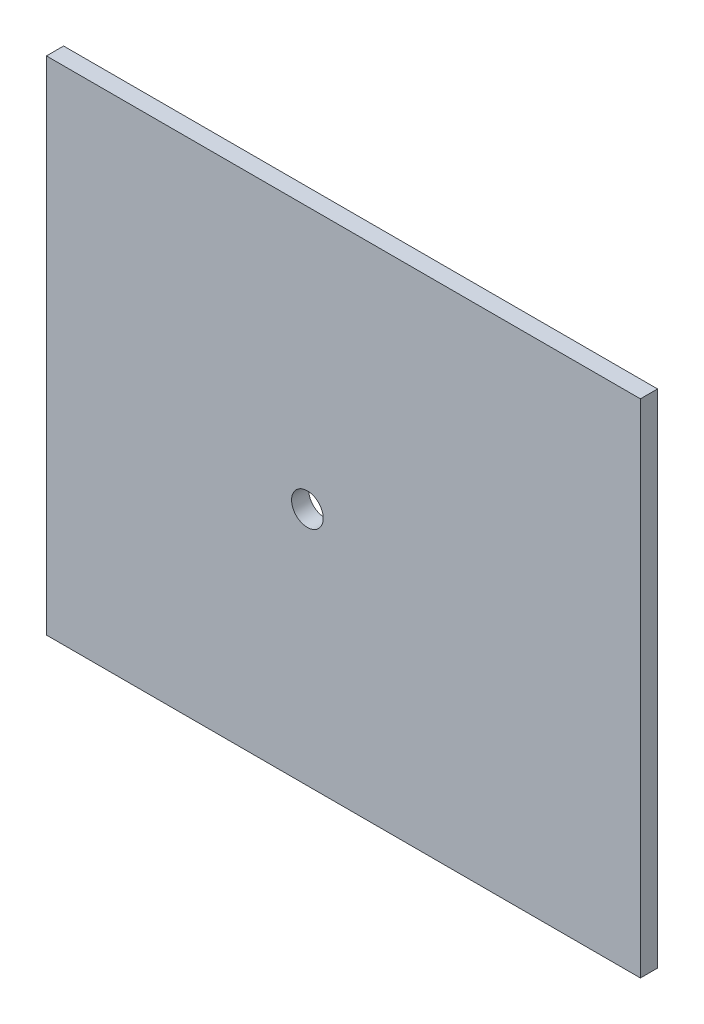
SolidWorks part; units mm, degrees
ref_plane "Plan de face" through (0, 0, 0) normal (0, 0, 1) x (1, 0, 0)
ref_plane "Plan de dessus" through (0, 0, 0) normal (0, 1, 0) x (1, 0, 0)
ref_plane "Plan de droite" through (0, 0, 0) normal (1, 0, 0) x (0, 0, -1)
sketch "Esquisse1" plane through (0, 0, 0) normal (0, 0, 1) x (1, 0, 0)
  line L1 (0, 0) -> (45, 0)
  line L2 (0, 0) -> (0, 38)
  line L3 (0, 38) -> (45, 38)
  line L4 (45, 0) -> (45, 38)
  dimension "D1" = 38
  dimension "D2" = 45
extrude "Extrusion1" add sketch "Esquisse1" along normal blind 1.3
sketch "Esquisse2" plane through (0, 0, 1.3) normal (0, 0, 1) x (1, 0, 0)
  circle A0 centre (19.7708, 18.148) radius 1.2
  dimension "D1" = 2.4
extrude "Enlèv. mat.-Extru.1" cut sketch "Esquisse2" against normal through all
